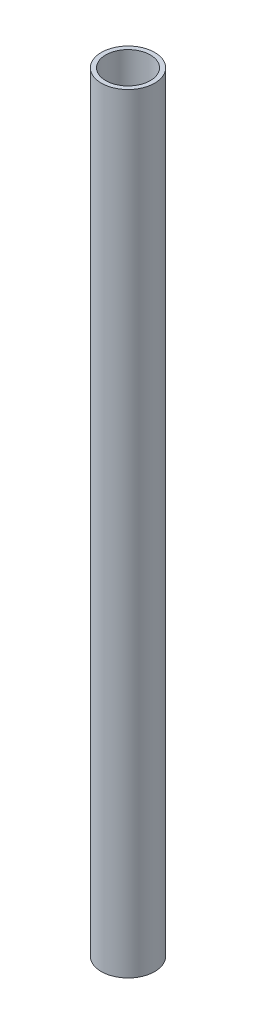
SolidWorks part; units mm, degrees
ref_plane "Front" through (0, 0, 0) normal (0, 0, 1) x (1, 0, 0)
ref_plane "Top" through (0, 0, 0) normal (0, 1, 0) x (1, 0, 0)
ref_plane "Right" through (0, 0, 0) normal (1, 0, 0) x (0, 0, -1)
sketch "Sketch1" plane through (0, 0, 0) normal (0, 1, 0) x (1, 0, 0)
  circle A0 centre (0, 0) radius 2.55
  dimension "D1" = 5.1
extrude "Extrude-Thin1" add sketch "Sketch1" along normal blind 88 thin
